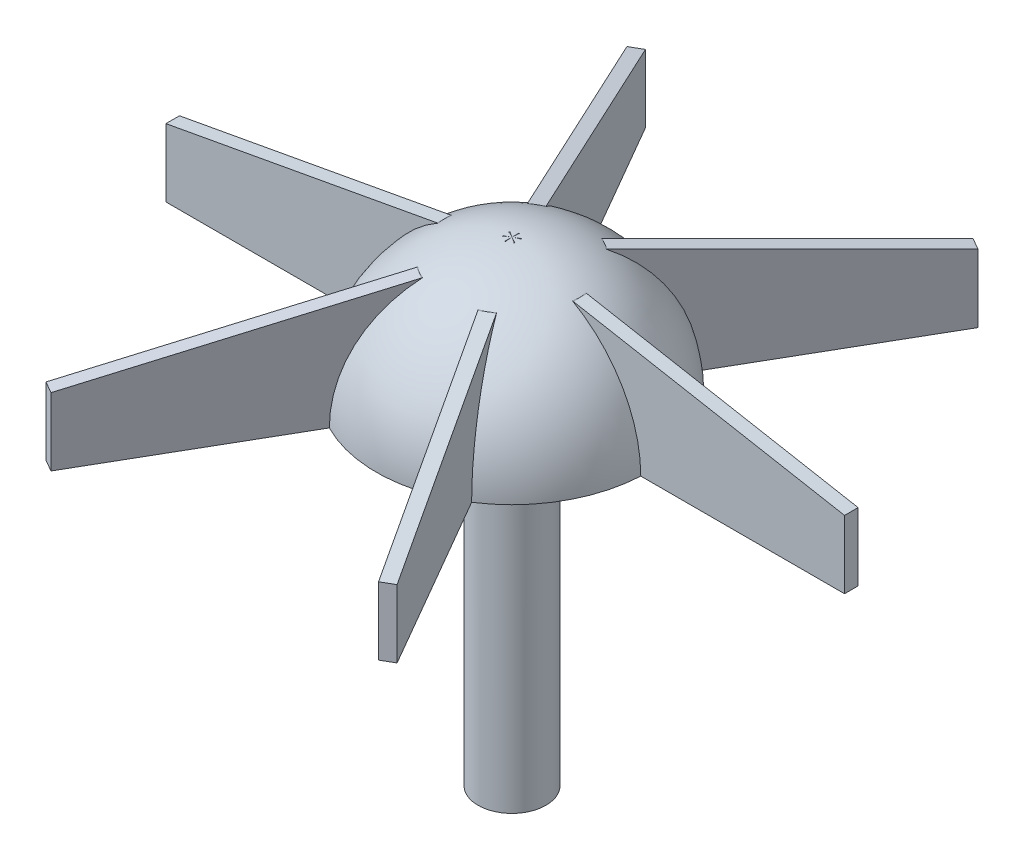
SolidWorks part; units mm, degrees
ref_plane "Ebene vorne" through (0, 0, 0) normal (0, 0, 1) x (1, 0, 0)
ref_plane "Ebene oben" through (0, 0, 0) normal (0, 1, 0) x (1, 0, 0)
ref_plane "Ebene rechts" through (0, 0, 0) normal (1, 0, 0) x (0, 0, -1)
sketch "Skizze1" plane through (0, 0, 0) normal (0, 1, 0) x (1, 0, 0)
  line L1 (-15, 15) -> (15, 15)
  line L2 (-15, 15) -> (-15, -15)
  line L3 (-15, -15) -> (15, -15)
  line L4 (15, 15) -> (15, -15)
  line L5 (-15, 15) -> (15, -15) construction
  line L6 (-15, -15) -> (15, 15) construction
  point P0 (0, 0)
  dimension "D1" = 30
extrude "Aufsatz-Linear austragen1" add sketch "Skizze1" along normal blind 50
sketch "Skizze2" plane through (0, 50, 0) normal (0, 1, 0) x (1, 0, 0)
  circle A0 centre (0, 0) radius 2.5
  dimension "D1" = 5
extrude "Aufsatz-Linear austragen2" add sketch "Skizze2" along normal blind 10
sketch "Skizze3" plane through (0, 0, 0) normal (1, 0, 0) x (0, 0, -1)
  line L0 (0, 60) -> (0, 70)
  line L1 (2.5, 60) -> (-2.5, 60) construction
  line L2 (10, 60) -> (0, 60)
  arc A0 (0, 70) -> (10, 60) centre (0, 60) cw
  dimension "D1" = 10
  dimension "D2" = 10
revolve "Rotation1" add sketch "Skizze3" angle 360 about L0
sketch "Skizze4" plane through (0, 0, 0) normal (0, 0, 1) x (1, 0, 0)
  line L0 (0, 60) -> (0, 70)
  line L1 (-10, 60) -> (10, 60) construction
  line L2 (0, 70) -> (5, 68.6603)
  line L3 (5, 68.6603) -> (25, 65)
  line L4 (25, 65) -> (25, 60)
  line L5 (25, 60) -> (0, 60)
  arc A0 (10, 60) -> (-10, 60) centre (0, 60) ccw construction
  dimension "D1" = 25
  dimension "D2" = 5
  dimension "D3" = 75
extrude "Aufsatz-Linear austragen3" add sketch "Skizze4" along normal mid plane 1
pattern_circular "Kreismuster1" count 6 over 360 about axis through (0, 0, 0) along (0, 1, 0) of "Aufsatz-Linear austragen3"
sketch "Sketch1" plane through (-15, 0, 0) normal (-1, 0, 0) x (0, 0, 1)
  line L1 (15, 50) -> (-15, 50)
  line L2 (15, 50) -> (15, 0)
  line L3 (15, 0) -> (-15, 0)
  line L4 (-15, 50) -> (-15, 0)
extrude "Cut-Extrude1" cut sketch "Sketch1" against normal through all
sketch "Sketch2" plane through (0, 50, 0) normal (0, -1, 0) x (1, 0, 0)
  circle A0 centre (0, 0) radius 2.5
extrude "Boss-Extrude1" add sketch "Sketch2" along normal blind 15
